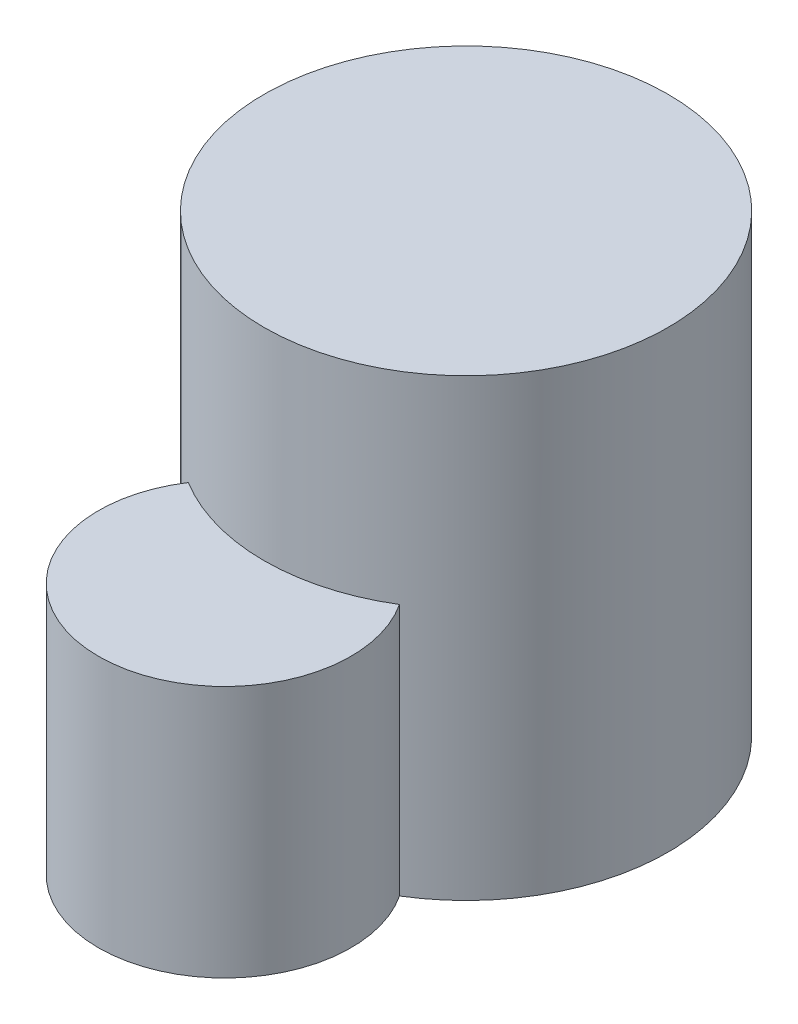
SolidWorks part; units mm, degrees
ref_plane "前视基准面" through (0, 0, 0) normal (0, 0, 1) x (1, 0, 0)
ref_plane "上视基准面" through (0, 0, 0) normal (0, 1, 0) x (1, 0, 0)
ref_plane "右视基准面" through (0, 0, 0) normal (1, 0, 0) x (0, 0, -1)
sketch "草图1" plane through (0, 0, 0) normal (0, 1, 0) x (1, 0, 0)
  circle A0 centre (0, 0) radius 8
  dimension "D1" = 16
extrude "凸台-拉伸1" add sketch "草图1" along normal blind 18
sketch "草图2" plane through (0, 0, 0) normal (0, 1, 0) x (1, 0, 0)
  circle A0 centre (0, -9.5586) radius 5
  dimension "D1" = 10
extrude "凸台-拉伸2" add sketch "草图2" along normal blind 10
